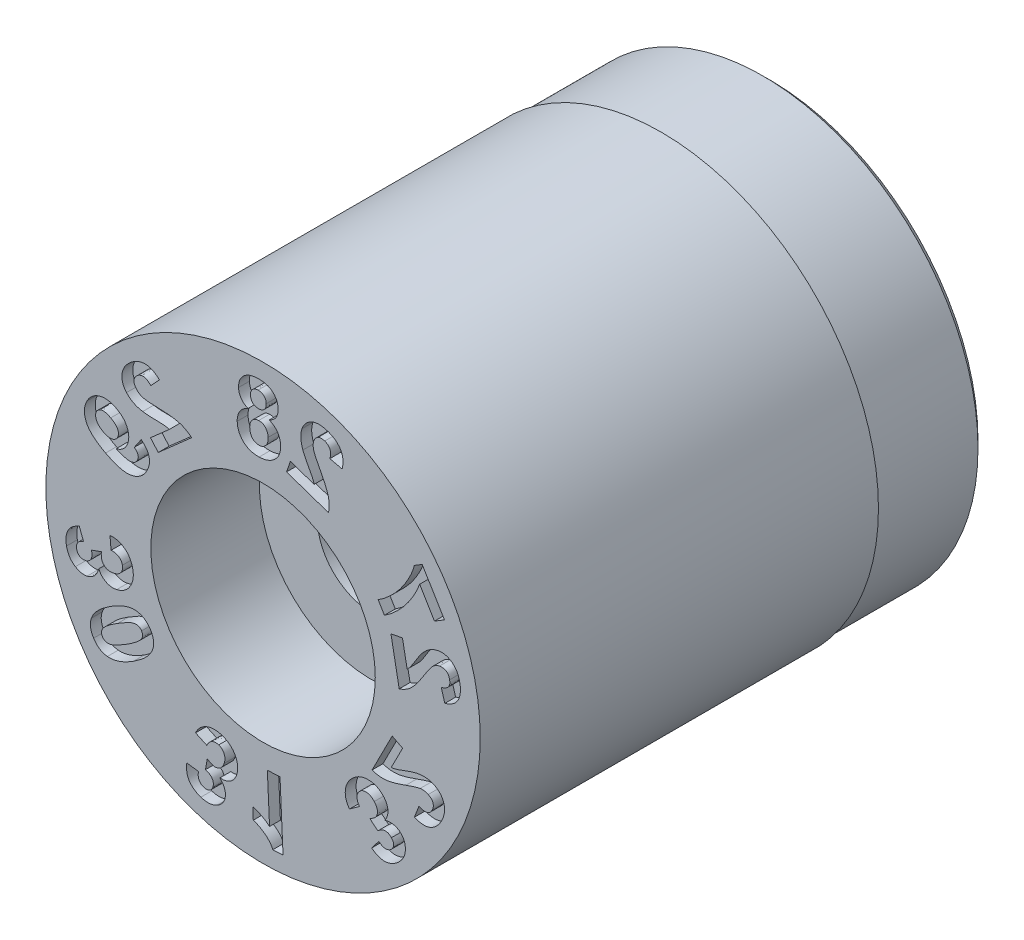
SolidWorks part; units mm, degrees
ref_plane "Front Plane" through (0, 0, 0) normal (0, 0, 1) x (1, 0, 0)
ref_plane "Top Plane" through (0, 0, 0) normal (0, 1, 0) x (1, 0, 0)
ref_plane "Right Plane" through (0, 0, 0) normal (1, 0, 0) x (0, 0, -1)
sketch "Sketch1" plane through (0, 0, 0) normal (1, 0, 0) x (0, 0, -1)
  line L2 (0, 6) -> (0, 3.1)
  line L3 (13.75, 6) -> (0, 6)
  line L4 (-3.7979, 0) -> (49996.2021, 0) construction
  line L8 (14, 1.5) -> (3, 1.5)
  line L9 (3, 3.1) -> (3, 1.5)
  line L10 (3, 3.1) -> (0, 3.1)
  line L12 (14, 1.5) -> (14, 5.75)
  line L16 (14, 5.75) -> (13.75, 6)
  dimension "D1" = 14
  dimension "D2" = 45
  dimension "D3" = 0.25
  dimension "D4" = 12
  dimension "D5" = 6.2
  dimension "D6" = 3
  dimension "D7" = 3
revolve "Revolve1" add sketch "Sketch1" angle 360 about L4
sketch "Sketch4" plane through (0, 0, 0) normal (1, 0, 0) x (0, 0, -1)
  line L0 (0, 0) -> (50000, 0) construction
  line L1 (14, -5.75) -> (14, 5.75) construction
  line L2 (11, 6.935) -> (14, 6.935)
  line L3 (11, 6.935) -> (11, 5.935)
  line L4 (11, 5.935) -> (14, 5.935)
  line L5 (14, 6.935) -> (14, 5.935)
  line L6 (13.75, 6) -> (0, 6) construction
  line L9 (0, 6.6) -> (0, -6.6) construction
  dimension "D1" = 1
  dimension "D2" = 0.065
  dimension "D3" = 11
revolve "Cut-Revolve1" cut sketch "Sketch4" angle 360 about L0
sketch "Sketch5" plane through (0, 0, 0) normal (0, 0, 1) x (1, 0, 0)
  circle A0 centre (0, 0) radius 3.7731 construction
  text T0 "27  28  29  30  31  32" font "Arial" height 1.84
  dimension "D1" = 7.5461
extrude "Cut-Extrude1" cut sketch "Sketch5" against normal blind 0.3
